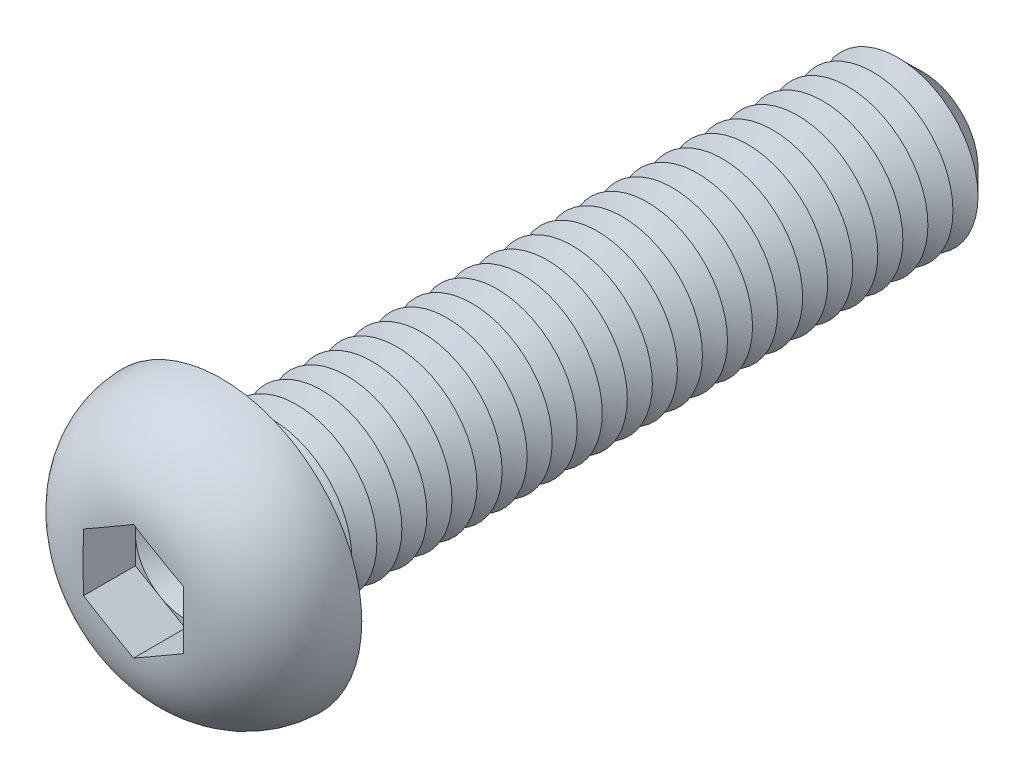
SolidWorks part; units mm, degrees
ref_plane "Front Plane" through (0, 0, 0) normal (0, 0, 1) x (1, 0, 0)
ref_plane "Top Plane" through (0, 0, 0) normal (0, 1, 0) x (1, 0, 0)
ref_plane "Right Plane" through (0, 0, 0) normal (1, 0, 0) x (0, 0, -1)
sketch "Sketch1" plane through (0, 0, 0) normal (1, 0, 0) x (0, 0, -1)
  line L0 (-47.9342, 0) -> (60.3146, 0) construction
sketch "Sketch2" plane through (0, 0, 0) normal (1, 0, 0) x (0, 0, -1)
  line L0 (0, 0) -> (-4.4, 0)
  line L1 (-47.9342, 0) -> (60.3146, 0) construction
  line L2 (-4.4, 0) -> (-4.4, 2.5011)
  line L3 (0, 7) -> (0, 0)
  arc A0 (-4.4, 2.5011) -> (0, 7) centre (0.1, 2.5011) cw
  dimension "D1" = 4.5
  dimension "D2" = 4.4
  dimension "D3" = 7
revolve "Revolve1" add sketch "Sketch2" angle 360 about L0
sketch "Sketch3" plane through (0, 0, 4.4) normal (0, 0, 1) x (1, 0, 0)
  line L1 (0, 2.8868) -> (-2.5, 1.4434)
  line L2 (-2.5, 1.4434) -> (-2.5, -1.4434)
  line L3 (-2.5, -1.4434) -> (0, -2.8868)
  line L4 (0, -2.8868) -> (2.5, -1.4434)
  line L5 (2.5, -1.4434) -> (2.5, 1.4434)
  line L6 (2.5, 1.4434) -> (0, 2.8868)
  circle A0 centre (0, 0) radius 2.5 construction
  dimension "D1" = 5
extrude "Cut-Extrude1" cut sketch "Sketch3" against normal blind 2.6
sketch "Sketch4" plane through (0, 0, 0) normal (0, 0, -1) x (-1, 0, 0)
  circle A0 centre (0, 0) radius 4
  dimension "D1" = 8
extrude "Boss-Extrude1" add sketch "Sketch4" along normal blind 35
chamfer "Chamfer1" distance 1.25 angle 45 1 edges at (-4, 0, -35)
sketch "Sketch5" plane through (0, 0, 0) normal (1, 0, 0) x (0, 0, -1)
  line L0 (1.25, 4) -> (2.5, 4)
  line L1 (33.75, 4) -> (0, 4) construction
  line L2 (2.5, 4) -> (1.875, 2.9175)
  line L3 (1.875, 2.9175) -> (1.25, 4)
  line L4 (0, -7) -> (0, 7) construction
  line L5 (33.75, 4) -> (0, 4) construction
  dimension "D1" = 1.25
  dimension "D2" = 1.25
revolve "Cut-Revolve1" cut sketch "Sketch5" angle 360 about L0
pattern_linear "LPattern1" count 26 spacing 1.25 along (0, 0, -1) of "Cut-Revolve1"
fillet "Fillet2" radius 0.5 1 edges at (4, 0, 0)
sketch "Sketch6" plane through (0, 0, 1.8) normal (0, 0, 1) x (1, 0, 0)
  line L0 (0, -2.8868) -> (2.5, -1.4434) construction
  circle A0 centre (0, 0) radius 2.5
extrude "Cut-Extrude2" cut sketch "Sketch6" against normal through all draft 60
